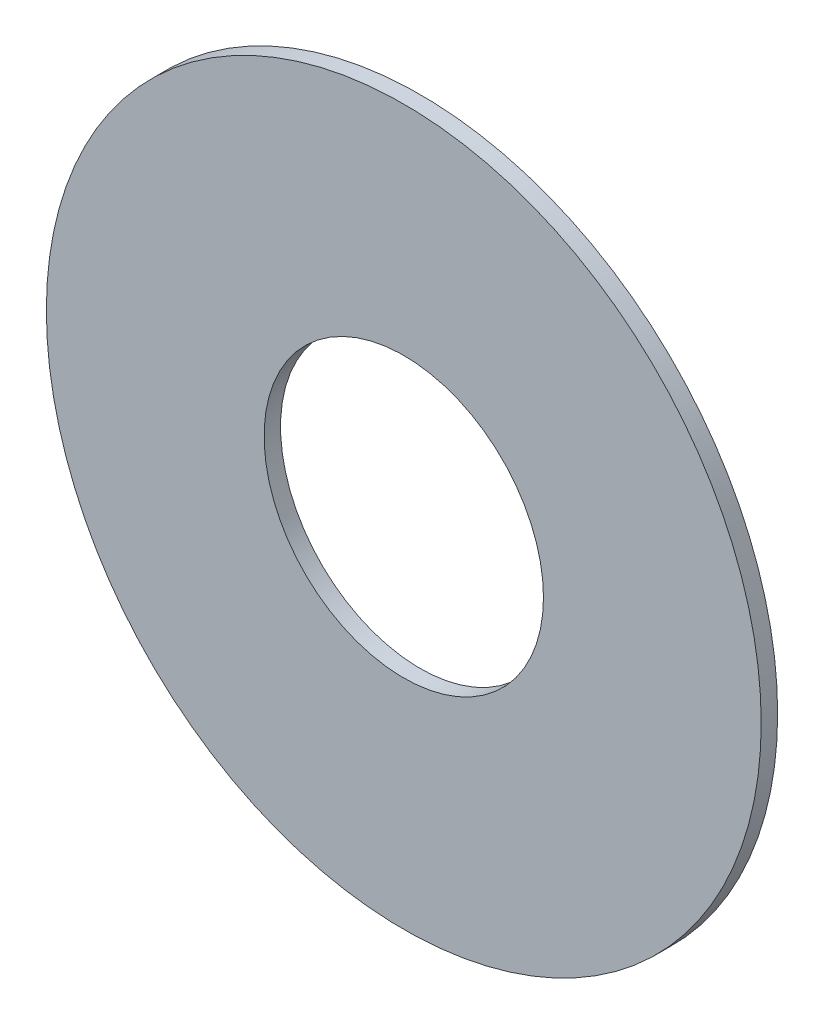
SolidWorks part; units mm, degrees
ref_plane "Front Plane" through (0, 0, 0) normal (0, 0, 1) x (1, 0, 0)
ref_plane "Top Plane" through (0, 0, 0) normal (0, 1, 0) x (1, 0, 0)
ref_plane "Right Plane" through (0, 0, 0) normal (1, 0, 0) x (0, 0, -1)
sketch "Sketch1" plane through (0, 0, 0) normal (0, 0, 1) x (1, 0, 0)
  circle A0 centre (0, 0) radius 2175
  circle A1 centre (0, 0) radius 850
  dimension "D1" = 4350
  dimension "D2" = 1700
extrude "Boss-Extrude1" add sketch "Sketch1" against normal blind 100
